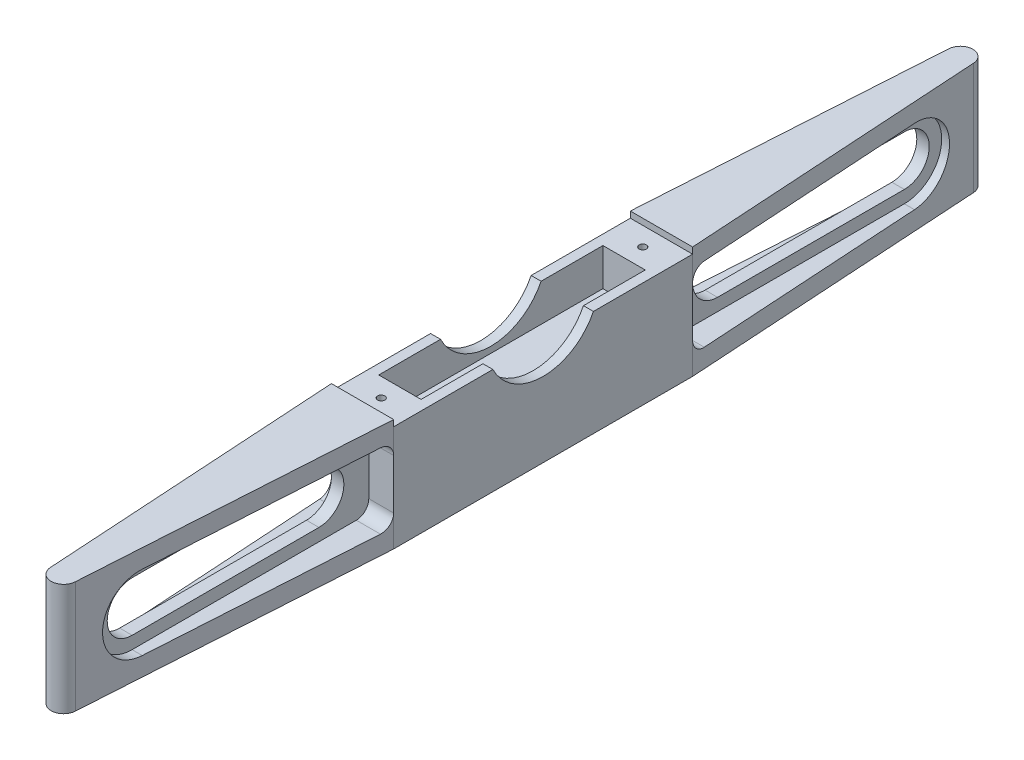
SolidWorks part; units mm, degrees
ref_plane "Front" through (0, 0, 0) normal (0, 0, 1) x (1, 0, 0)
ref_plane "Top" through (0, 0, 0) normal (0, 1, 0) x (1, 0, 0)
ref_plane "Right" through (0, 0, 0) normal (1, 0, 0) x (0, 0, -1)
sketch "Sketch1" plane through (0, 0, 0) normal (0, 1, 0) x (1, 0, 0)
  line L0 (0, 0) -> (55.1982, 0) construction
  line L1 (0, 0) -> (0, 49.235) construction
  line L2 (7.9375, 38.1) -> (3.1688, 114.4978)
  line L3 (-7.9375, 38.1) -> (-3.1688, 114.4978)
  line L4 (7.9375, 38.1) -> (7.9375, -38.1)
  line L5 (-7.9375, 38.1) -> (-7.9375, -38.1)
  line L6 (-7.9375, -38.1) -> (-3.1688, -114.4978)
  line L7 (7.9375, -38.1) -> (3.1688, -114.4978)
  arc A0 (-3.1688, 114.4978) -> (3.1688, 114.4978) centre (0, 114.3) cw
  arc A1 (-3.1688, -114.4978) -> (3.1688, -114.4978) centre (0, -114.3) ccw
  point P15 (-7.9375, 0)
  point P16 (7.9375, 0)
  dimension "D2" = 3.175
  dimension "D1" = 228.6
  dimension "D3" = 76.2
  dimension "D4" = 15.875
extrude "Base-Extrude" add sketch "Sketch1" along normal blind 28.575
sketch "Sketch2" plane through (7.9375, 0, 0) normal (1, 0, 0) x (0, 0, -1)
  line L0 (-38.1, 14.2875) -> (-127.9941, 14.2875) construction
  line L1 (-38.1, 28.575) -> (-38.1, 0) construction
  line L2 (-38.1, 4.7625) -> (-98.425, 4.7625)
  line L3 (-38.1, 23.8125) -> (-98.425, 23.8125)
  line L4 (-117.475, 28.575) -> (-117.475, 0) construction
  line L5 (-38.1, 23.8125) -> (-38.1, 4.7625)
  arc A0 (-98.425, 4.7625) -> (-98.425, 23.8125) centre (-98.425, 14.2875) cw
  dimension "D1" = 9.525
  dimension "D2" = 19.05
extrude "Cut-Extrude1" cut sketch "Sketch2" against normal blind 6.35
fillet "Fillet1" radius 3.175 2 edges at (4.7625, 23.8125, 38.1) (4.7625, 4.7625, 38.1)
mirror "Mirror1" about plane through (0, 0, 0) normal (1, 0, 0) of "Fillet1", "Cut-Extrude1"
mirror "Mirror2" about plane through (0, 0, 0) normal (0, 0, 1) of "Mirror1", "Cut-Extrude1", "Fillet1"
sketch "Sketch3" plane through (1.5875, 0, 0) normal (1, 0, 0) x (0, 0, -1)
  line L0 (-38.1, 20.6375) -> (-38.1, 7.9375) construction
  line L2 (-41.275, 20.6375) -> (-98.425, 20.6375)
  line L3 (-41.275, 7.9375) -> (-98.425, 7.9375)
  line L4 (-50.8, 20.6375) -> (-98.425, 20.6375)
  line L5 (-50.8, 7.9375) -> (-98.425, 7.9375)
  arc A0 (-50.8, 20.6375) -> (-50.8, 7.9375) centre (-50.8, 14.2875) cw
  arc A1 (-98.425, 20.6375) -> (-98.425, 7.9375) centre (-98.425, 14.2875) ccw
  arc A2 (-98.425, 20.6375) -> (-98.425, 7.9375) centre (-98.425, 14.2875) ccw
  dimension "D2" = 12.7
  dimension "D1" = 3.175
extrude "Cut-Extrude2" cut sketch "Sketch3" against normal through all
mirror "Mirror3" about plane through (0, 0, 0) normal (0, 0, 1) of "Cut-Extrude2"
sketch "Sketch5" plane through (0, 28.575, 0) normal (0, 1, 0) x (-1, 0, 0)
  line L0 (7.9375, 38.1) -> (-7.9375, 38.1)
  line L1 (7.9375, 38.1) -> (7.9375, -38.1)
  line L2 (-7.9375, -38.1) -> (7.9375, -38.1)
  line L3 (-7.9375, -38.1) -> (-7.9375, 38.1)
  line L4 (0, 0) -> (0, -42.9632) construction
  line L5 (7.9375, -38.1) -> (7.9375, 38.1) construction
  line L6 (-7.9375, -38.1) -> (-7.9375, 38.1) construction
extrude "Cut-Extrude3" cut sketch "Sketch5" against normal blind 1.5875
sketch "Sketch6" plane through (0, 26.9875, 0) normal (0, 1, 0) x (-1, 0, 0)
  line L0 (7.9375, 0) -> (-28.7818, 0) construction
  line L1 (-7.9375, -38.1) -> (-7.9375, 38.1) construction
  line L2 (-5.3975, -28.575) -> (-5.3975, 28.575)
  line L3 (5.3975, 38.1) -> (5.3975, -38.1)
  line L4 (5.3975, 28.575) -> (5.3975, -28.575)
  line L5 (7.9375, 38.1) -> (7.9375, -38.1) construction
  line L6 (5.3975, 28.575) -> (-5.3975, 28.575)
  line L7 (5.3975, -28.575) -> (-5.3975, -28.575)
  dimension "D1" = 2.54
  dimension "D3" = 57.15
  dimension "D2" = 2.54
extrude "Cut-Extrude4" cut sketch "Sketch6" against normal blind 9.525
sketch "Sketch7" plane through (7.9375, 0, 0) normal (1, 0, 0) x (0, 0, -1)
  line L0 (28.575, 17.4625) -> (-28.575, 17.4625) construction
  circle A0 centre (0, 33.3375) radius 14.3002
  dimension "D1" = 28.6004
  dimension "D2" = 15.875
extrude "Cut-Extrude5" cut sketch "Sketch7" against normal through all
sketch "Sketch8" plane through (0, 26.9875, 0) normal (0, 1, 0) x (-1, 0, 0)
  line L0 (0, 0) -> (-7.9375, 0) construction
  line L1 (-5.3975, 0) -> (-7.9375, 0) construction
  line L2 (0, 0) -> (0, -23.9678) construction
  circle A0 centre (0, -33.3375) radius 0.9271
  circle A1 centre (0, 33.3375) radius 0.9271
  dimension "D1" = 1.8542
  dimension "D2" = 66.675
extrude "Cut-Extrude6" cut sketch "Sketch8" against normal blind 12.7
